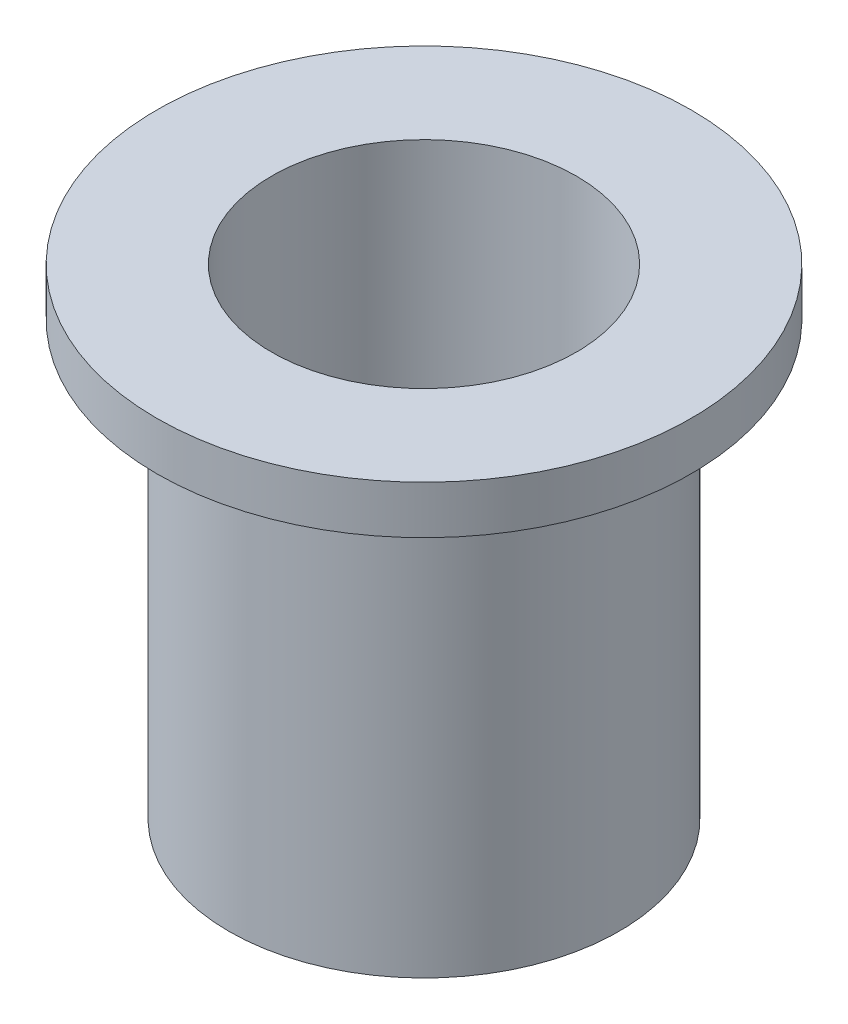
SolidWorks part; units mm, degrees
ref_plane "Front Plane" through (0, 0, 0) normal (0, 0, 1) x (1, 0, 0)
ref_plane "Top Plane" through (0, 0, 0) normal (0, 1, 0) x (1, 0, 0)
ref_plane "Right Plane" through (0, 0, 0) normal (1, 0, 0) x (0, 0, -1)
sketch "Sketch1" plane through (0, 0, 0) normal (1, 0, 0) x (0, 0, -1)
  line L0 (0, 0) -> (0, 51.8132) construction
  line L1 (3.175, 1) -> (3.175, -9)
  line L2 (3.175, -9) -> (4.0625, -9)
  line L3 (4.0625, -9) -> (4.0625, 0)
  line L4 (4.0625, 0) -> (5.5625, 0)
  line L5 (5.5625, 0) -> (5.5625, 1)
  line L6 (5.5625, 1) -> (3.175, 1)
  dimension "D1" = 6.35
  dimension "D2" = 8.125
  dimension "D3" = 1
  dimension "D4" = 10
  dimension "D5" = 1.5
revolve "Revolve1" add sketch "Sketch1" angle 360 about L0
